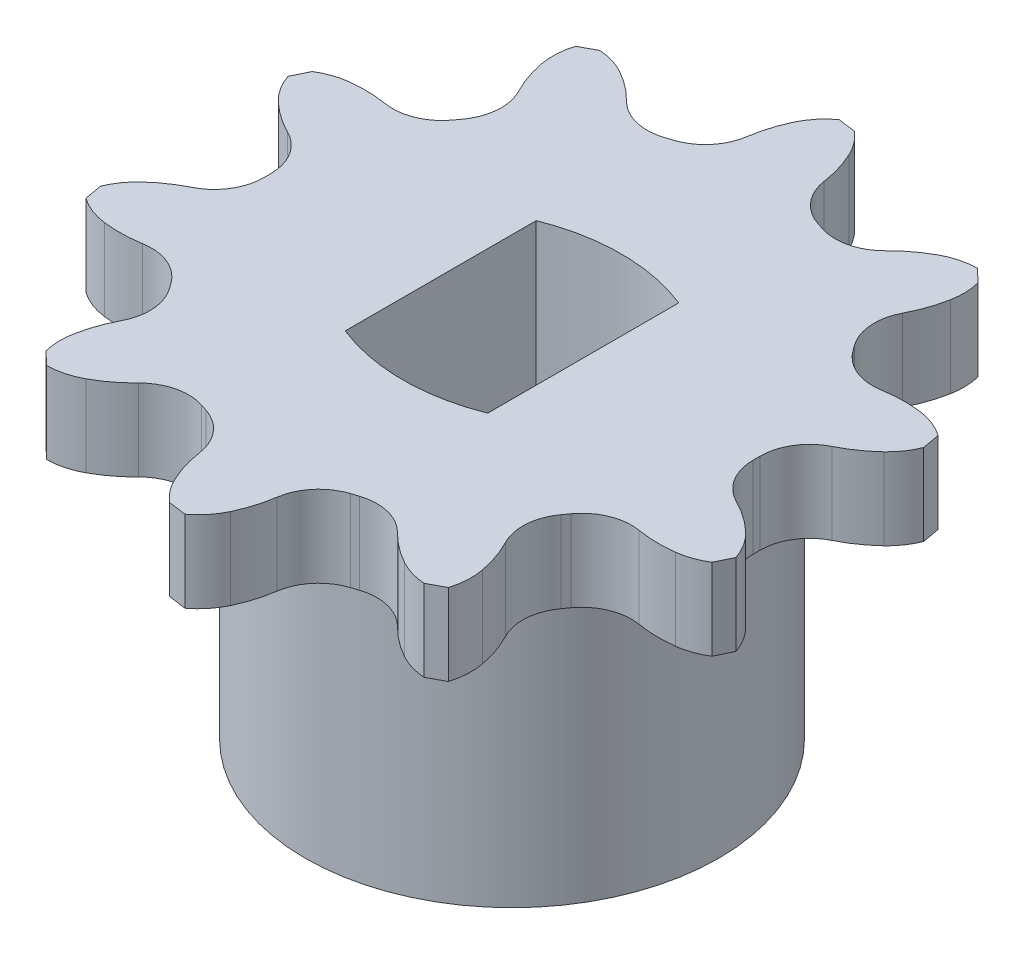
SolidWorks part; units mm, degrees
ref_plane "Front Plane" through (0, 0, 0) normal (0, 0, 1) x (1, 0, 0)
ref_plane "Top Plane" through (0, 0, 0) normal (0, 1, 0) x (1, 0, 0)
ref_plane "Right Plane" through (0, 0, 0) normal (1, 0, 0) x (0, 0, -1)
ref_plane "Plane1" through (0, 14.8844, 0) normal (0, -1, 0) x (1, 0, 0)
sketch "Sketch1" plane through (0, 14.8844, 0) normal (0, -1, 0) x (1, 0, 0)
  line L0 (-12.8207, 1.9877) -> (-12.8207, -1.9877)
  line L1 (-11.5405, -5.9277) -> (-9.2038, -9.1439)
  line L2 (-5.8522, -11.5789) -> (-2.0714, -12.8074)
  line L3 (2.0714, -12.8074) -> (5.8522, -11.5789)
  line L4 (9.2038, -9.1439) -> (11.5405, -5.9277)
  line L5 (12.8207, -1.9877) -> (12.8207, 1.9877)
  line L6 (11.5405, 5.9277) -> (9.2038, 9.1439)
  line L7 (5.8522, 11.5789) -> (2.0714, 12.8074)
  line L8 (-2.0714, 12.8074) -> (-5.8522, 11.5789)
  line L9 (-9.2038, 9.1439) -> (-11.5405, 5.9277)
  arc A0 (-15.8685, 3.6214) -> (-12.8207, 1.9877) centre (-11.3104, 8.4653) ccw
  arc A1 (-12.8207, -1.9877) -> (-15.8685, -3.6214) centre (-11.3104, -8.4653) ccw
  arc A2 (-15.8685, -3.6214) -> (-16.905, -5.4928) centre (-13.4658, -6.1747) ccw
  arc A3 (-16.905, -5.4928) -> (-14.9665, -6.3975) centre (-14.5235, -2.9195) ccw
  arc A4 (-14.9665, -6.3975) -> (-11.5405, -5.9277) centre (-14.1261, 0.2005) ccw
  arc A5 (-9.2038, -9.1439) -> (-10.7093, -12.257) centre (-4.1745, -13.4967) ccw
  arc A6 (-10.7093, -12.257) -> (-10.4478, -14.3802) centre (-7.2646, -12.9105) ccw
  arc A7 (-10.4478, -14.3802) -> (-8.3478, -13.9728) centre (-10.0337, -10.8986) ccw
  arc A8 (-8.3478, -13.9728) -> (-5.8522, -11.5789) centre (-11.5461, -8.1409) ccw
  arc A9 (-2.0714, -12.8074) -> (-1.4595, -16.2109) centre (4.5559, -13.3728) ccw
  arc A10 (-1.4595, -16.2109) -> (0, -17.7749) centre (1.7114, -14.7148) ccw
  arc A11 (0, -17.7749) -> (1.4595, -16.2109) centre (-1.7114, -14.7148) ccw
  arc A12 (1.4595, -16.2109) -> (2.0714, -12.8074) centre (-4.5559, -13.3728) ccw
  arc A13 (5.8522, -11.5789) -> (8.3478, -13.9728) centre (11.5461, -8.1409) ccw
  arc A14 (8.3478, -13.9728) -> (10.4478, -14.3802) centre (10.0337, -10.8986) ccw
  arc A15 (10.4478, -14.3802) -> (10.7093, -12.257) centre (7.2646, -12.9105) ccw
  arc A16 (10.7093, -12.257) -> (9.2038, -9.1439) centre (4.1745, -13.4967) ccw
  arc A17 (11.5405, -5.9277) -> (14.9665, -6.3975) centre (14.1261, 0.2005) ccw
  arc A18 (14.9665, -6.3975) -> (16.905, -5.4928) centre (14.5235, -2.9195) ccw
  arc A19 (16.905, -5.4928) -> (15.8685, -3.6214) centre (13.4658, -6.1747) ccw
  arc A20 (15.8685, -3.6214) -> (12.8207, -1.9877) centre (11.3104, -8.4653) ccw
  arc A21 (12.8207, 1.9877) -> (15.8685, 3.6214) centre (11.3104, 8.4653) ccw
  arc A22 (15.8685, 3.6214) -> (16.905, 5.4928) centre (13.4658, 6.1747) ccw
  arc A23 (16.905, 5.4928) -> (14.9665, 6.3975) centre (14.5235, 2.9195) ccw
  arc A24 (14.9665, 6.3975) -> (11.5405, 5.9277) centre (14.1261, -0.2005) ccw
  arc A25 (9.2038, 9.1439) -> (10.7093, 12.257) centre (4.1745, 13.4967) ccw
  arc A26 (10.7093, 12.257) -> (10.4478, 14.3802) centre (7.2646, 12.9105) ccw
  arc A27 (10.4478, 14.3802) -> (8.3478, 13.9728) centre (10.0337, 10.8986) ccw
  arc A28 (8.3478, 13.9728) -> (5.8522, 11.5789) centre (11.5461, 8.1409) ccw
  arc A29 (2.0714, 12.8074) -> (1.4595, 16.2109) centre (-4.5559, 13.3728) ccw
  arc A30 (1.4595, 16.2109) -> (0, 17.7749) centre (-1.7114, 14.7148) ccw
  arc A31 (0, 17.7749) -> (-1.4595, 16.2109) centre (1.7114, 14.7148) ccw
  arc A32 (-1.4595, 16.2109) -> (-2.0714, 12.8074) centre (4.5559, 13.3728) ccw
  arc A33 (-5.8522, 11.5789) -> (-8.3478, 13.9728) centre (-11.5461, 8.1409) ccw
  arc A34 (-8.3478, 13.9728) -> (-10.4478, 14.3802) centre (-10.0337, 10.8986) ccw
  arc A35 (-10.4478, 14.3802) -> (-10.7093, 12.257) centre (-7.2646, 12.9105) ccw
  arc A36 (-10.7093, 12.257) -> (-9.2038, 9.1439) centre (-4.1745, 13.4967) ccw
  arc A37 (-11.5405, 5.9277) -> (-14.9665, 6.3975) centre (-14.1261, -0.2005) ccw
  arc A38 (-14.9665, 6.3975) -> (-16.905, 5.4928) centre (-14.5235, 2.9195) ccw
  arc A39 (-16.905, 5.4928) -> (-15.8685, 3.6214) centre (-13.4658, 6.1747) ccw
extrude "Boss-Extrude1" add sketch "Sketch1" against normal blind 4.2672
ref_plane "Plane2" through (0, 0, 0) normal (0, 0, -1) x (-1, 0, 0)
sketch "Sketch2" plane through (0, 0, 0) normal (0, 0, -1) x (-1, 0, 0)
  line L0 (-10.8379, 0) -> (0, 0)
  line L1 (0, 0) -> (0, 14.8844)
  line L2 (0, 14.8844) -> (-10.8379, 14.8844)
  line L3 (-10.8379, 14.8844) -> (-10.8379, 10.6299)
  line L5 (-10.8379, 10.6299) -> (-10.8379, 0)
  line L6 (0, 0) -> (0, 14.8844) construction
revolve "Revolve1" add sketch "Sketch2" angle 360 about L6
chamfer "Chamfer1" distance 0.4997 angle 37.008 10 edges at (-16.905, 17.018, -5.4928) (-10.4478, 17.018, -14.3802) (16.905, 17.018, 5.4928) (10.4478, 17.018, 14.3802) (-10.4478, 17.018, 14.3802) (0, 17.018, -17.7749) (-16.905, 17.018, 5.4928) (0, 17.018, 17.7749) (10.4478, 17.018, -14.3802) (16.905, 17.018, -5.4928)
fillet "Fillet1" radius 2.5908 20 edges at (2.0714, 17.018, 12.8074) (-9.2038, 17.018, 9.1439) (9.2038, 17.018, 9.1439) (12.8207, 17.018, -1.9877) (-11.5405, 17.018, 5.9277) (-2.0714, 17.018, -12.8074) (-12.8207, 17.018, 1.9877) (-2.0714, 17.018, 12.8074) (-9.2038, 17.018, -9.1439) (-5.8522, 17.018, -11.5789) (-11.5405, 17.018, -5.9277) (-5.8522, 17.018, 11.5789) (2.0714, 17.018, -12.8074) (12.8207, 17.018, 1.9877) (9.2038, 17.018, -9.1439) (11.5405, 17.018, -5.9277) (-12.8207, 17.018, -1.9877) (11.5405, 17.018, 5.9277) (5.8522, 17.018, 11.5789) (5.8522, 17.018, -11.5789)
sketch "Sketch5" plane through (0, 19.1516, 0) normal (0, 1, 0) x (1, 0, 0)
  line L2 (-3.7338, 5.0038) -> (-3.7338, -5.0038)
  line L4 (3.7338, 5.0038) -> (3.7338, -5.0038)
  line L5 (-3.7338, 5.0038) -> (3.7338, -5.0038) construction
  line L6 (-3.7338, -5.0038) -> (3.7338, 5.0038) construction
  arc A0 (-3.7338, 5.0038) -> (3.7338, 5.0038) centre (0, -4.3222) cw
  arc A1 (-3.7338, -5.0038) -> (3.7338, -5.0038) centre (0, 4.3222) ccw
  point P0 (0, 0)
  dimension "D2" = 10.0457
  dimension "D1" = 7.4676
  dimension "D3" = 10.0076
extrude "Cut-Extrude1" cut sketch "Sketch5" against normal through all
